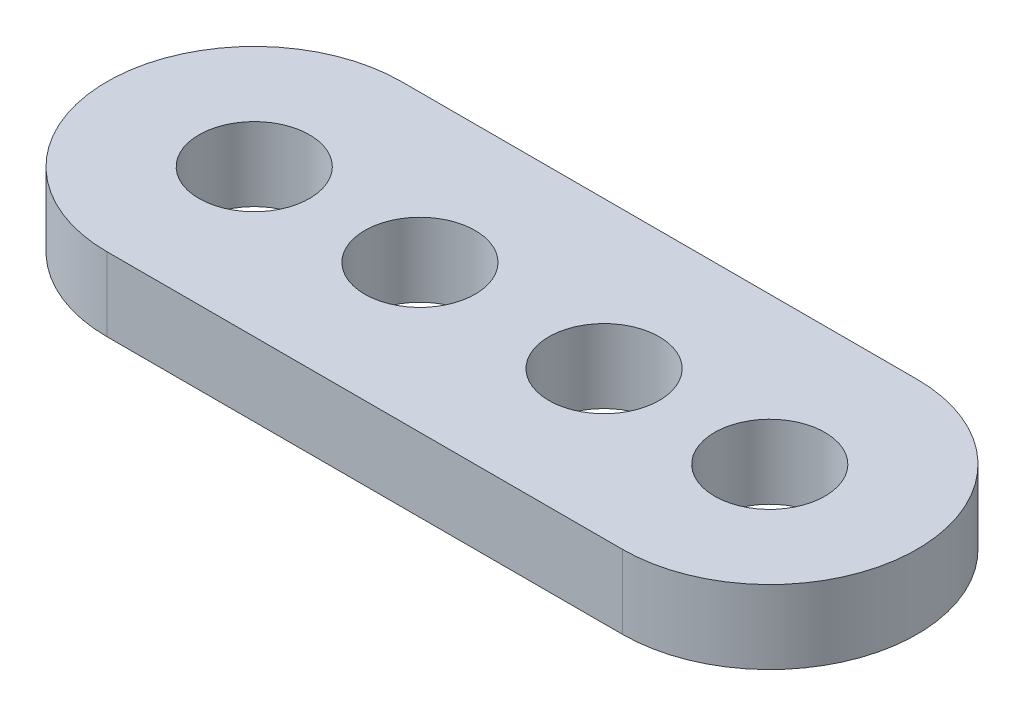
SolidWorks part; units mm, degrees
ref_plane "Front" through (0, 0, 0) normal (0, 0, 1) x (1, 0, 0)
ref_plane "Top" through (0, 0, 0) normal (0, 1, 0) x (1, 0, 0)
ref_plane "Right" through (0, 0, 0) normal (1, 0, 0) x (0, 0, -1)
sketch "草图1" plane through (0, 0, 0) normal (0, 1, 0) x (1, 0, 0)
  line L0 (0, 0) -> (14, 0) construction
  line L1 (0, 4) -> (14, 4)
  line L2 (0, -4) -> (14, -4)
  arc A0 (0, 4) -> (0, -4) centre (0, 0) ccw
  arc A1 (14, -4) -> (14, 4) centre (14, 0) ccw
  circle A2 centre (0, 0) radius 1.5
  circle A3 centre (14, 0) radius 1.5
  circle A4 centre (4.5, 0) radius 1.5
  circle A5 centre (9.5, 0) radius 1.5
  point P3 (7, 0)
  dimension "D2" = 4
  dimension "D3" = 3
  dimension "D4" = 3
  dimension "D5" = 3
  dimension "D6" = 3
  dimension "D1" = 14
  dimension "D7" = 5
  dimension "D8" = 2.5
extrude "凸台-拉伸1" add sketch "草图1" along normal blind 2
